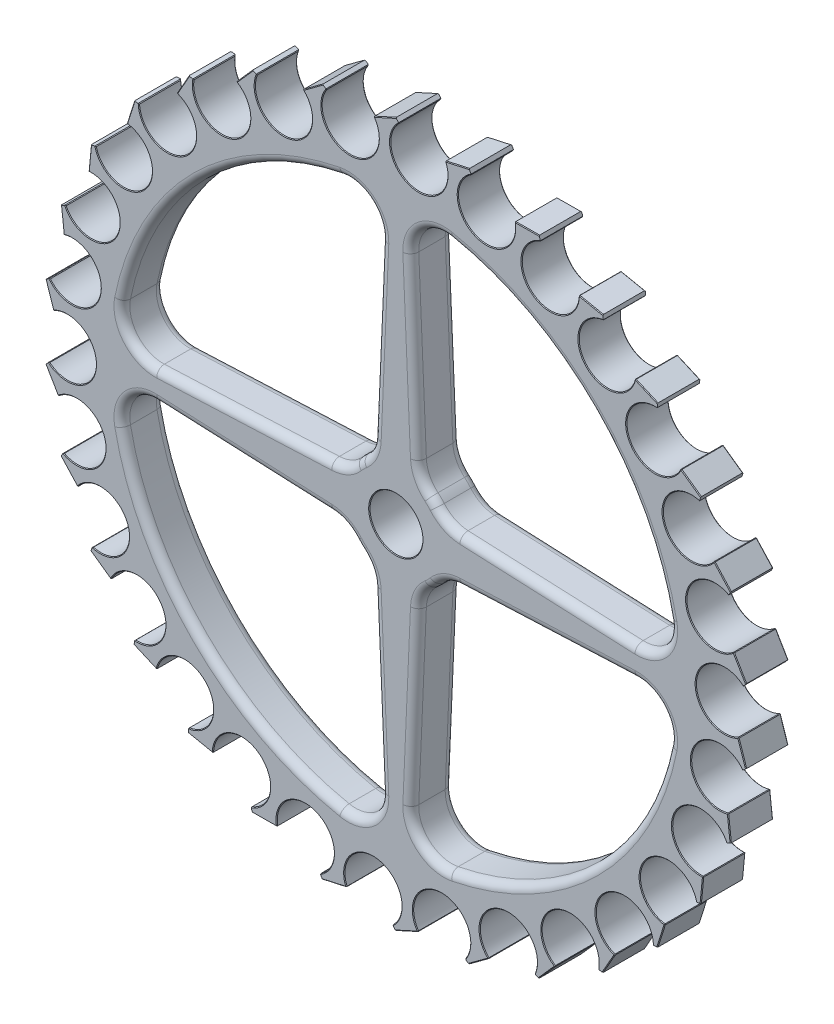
SolidWorks part; units mm, degrees
ref_plane "Спереди" through (0, 0, 0) normal (0, 0, 1) x (1, 0, 0)
ref_plane "Сверху" through (0, 0, 0) normal (0, 1, 0) x (1, 0, 0)
ref_plane "Справа" through (0, 0, 0) normal (1, 0, 0) x (0, 0, -1)
sketch "Эскиз1" plane through (0, 0, 0) normal (0, 0, 1) x (1, 0, 0)
  line L0 (0, 133) -> (0, 0) construction
  line L1 (0, 0) -> (9.2776, 132.676) construction
  line L2 (0, 133) -> (-8.4358, 129.1584)
  line L3 (27.6523, 130.0936) -> (18.6021, 128.0898)
  line L4 (54.096, 121.5015) -> (44.827, 121.4232)
  line L5 (78.1754, 107.5993) -> (69.0927, 109.4497)
  line L6 (98.8383, 88.9944) -> (90.3387, 92.6928)
  line L7 (115.1814, 66.5) -> (107.6365, 71.8848)
  line L8 (126.4905, 41.0993) -> (120.2301, 47.935)
  line L9 (132.2714, 13.9023) -> (127.569, 21.8903)
  line L10 (132.2714, -13.9023) -> (129.3326, -5.1111)
  line L11 (126.4905, -41.0993) -> (125.4437, -31.8892)
  line L12 (115.1814, -66.5) -> (116.0723, -57.2736)
  line L13 (98.8383, -88.9944) -> (101.628, -80.1548)
  line L14 (78.1754, -107.5993) -> (82.7421, -99.5329)
  line L15 (54.096, -121.5015) -> (60.2399, -114.5609)
  line L16 (27.6523, -130.0936) -> (35.105, -124.582)
  line L17 (0, -133) -> (8.4358, -129.1584)
  line L18 (-27.6523, -130.0936) -> (-18.6021, -128.0898)
  line L19 (-54.096, -121.5015) -> (-44.827, -121.4232)
  line L20 (-78.1754, -107.5993) -> (-69.0927, -109.4497)
  line L21 (-98.8383, -88.9944) -> (-90.3387, -92.6928)
  line L22 (-115.1814, -66.5) -> (-107.6365, -71.8848)
  line L23 (-126.4905, -41.0993) -> (-120.2301, -47.935)
  line L24 (-132.2714, -13.9023) -> (-127.569, -21.8903)
  line L25 (-132.2714, 13.9023) -> (-129.3326, 5.1111)
  line L26 (-126.4905, 41.0993) -> (-125.4437, 31.8892)
  line L27 (-115.1814, 66.5) -> (-116.0723, 57.2736)
  line L28 (-98.8383, 88.9944) -> (-101.628, 80.1548)
  line L29 (-78.1754, 107.5993) -> (-82.7421, 99.5329)
  line L30 (-54.096, 121.5015) -> (-60.2399, 114.5609)
  line L31 (-27.6523, 130.0936) -> (-35.105, 124.582)
  line L32 (0, 133) -> (1.2296, 131.7036)
  line L33 (27.6523, 130.0936) -> (28.5854, 128.5699)
  line L34 (54.096, 121.5015) -> (54.6919, 119.8171)
  line L35 (78.1754, 107.5993) -> (78.4082, 105.8277)
  line L36 (98.8383, 88.9944) -> (98.6976, 87.2132)
  line L37 (115.1814, 66.5) -> (114.6734, 64.787)
  line L38 (126.4905, 41.0993) -> (125.6375, 39.5293)
  line L39 (132.2714, 13.9023) -> (131.1106, 12.5439)
  line L40 (132.2714, -13.9023) -> (130.8536, -14.9896)
  line L41 (126.4905, -41.0993) -> (124.8776, -41.868)
  line L42 (115.1814, -66.5) -> (113.4439, -66.9166)
  line L43 (98.8383, -88.9944) -> (97.0521, -89.0407)
  line L44 (78.1754, -107.5993) -> (76.4187, -107.2732)
  line L45 (54.096, -121.5015) -> (52.4454, -120.8173)
  line L46 (27.6523, -130.0936) -> (26.18, -129.0812)
  line L47 (0, -133) -> (-1.2296, -131.7036)
  line L48 (-27.6523, -130.0936) -> (-28.5854, -128.5699)
  line L49 (-54.096, -121.5015) -> (-54.6919, -119.8171)
  line L50 (-78.1754, -107.5993) -> (-78.4082, -105.8277)
  line L51 (-98.8383, -88.9944) -> (-98.6976, -87.2132)
  line L52 (-115.1814, -66.5) -> (-114.6734, -64.787)
  line L53 (-126.4905, -41.0993) -> (-125.6375, -39.5293)
  line L54 (-132.2714, -13.9023) -> (-131.1106, -12.5439)
  line L55 (-132.2714, 13.9023) -> (-130.8536, 14.9896)
  line L56 (-126.4905, 41.0993) -> (-124.8776, 41.868)
  line L57 (-115.1814, 66.5) -> (-113.4439, 66.9166)
  line L58 (-98.8383, 88.9944) -> (-97.0521, 89.0407)
  line L59 (-78.1754, 107.5993) -> (-76.4187, 107.2732)
  line L60 (-54.096, 121.5015) -> (-52.4454, 120.8173)
  line L61 (-27.6523, 130.0936) -> (-26.18, 129.0812)
  line L62 (0, 0) -> (-133, 0) construction
  line L63 (-5.657, 90.4125) -> (-8.5437, 24.2976)
  line L64 (-90.4125, 5.657) -> (-24.2976, 8.5437)
  line L65 (-5.0144, 105.1305) -> (-3.8, 132.9457) construction
  line L66 (-105.1305, 5.0144) -> (-132.9457, 3.8) construction
  line L67 (90.4125, 5.657) -> (24.2976, 8.5437)
  line L68 (5.657, 90.4125) -> (8.5437, 24.2976)
  line L69 (5.657, -90.4125) -> (8.5437, -24.2976)
  line L70 (90.4125, -5.657) -> (24.2976, -8.5437)
  line L71 (-90.4125, -5.657) -> (-24.2976, -8.5437)
  line L72 (-5.657, -90.4125) -> (-8.5437, -24.2976)
  circle A0 centre (0, 0) radius 10
  circle A1 centre (0, 0) radius 133 construction
  circle A2 centre (0, 0) radius 124.17 construction
  arc A3 (1.2296, 131.7036) -> (18.6021, 128.0898) centre (8.6617, 123.8675) ccw
  arc A4 (28.5854, 128.5699) -> (44.827, 121.4232) centre (34.2259, 119.3599) ccw
  arc A5 (54.6919, 119.8171) -> (69.0927, 109.4497) centre (58.2943, 109.6356) ccw
  arc A6 (78.4082, 105.8277) -> (90.3387, 92.6928) centre (79.8149, 95.1197) ccw
  arc A7 (98.6976, 87.2132) -> (107.6365, 71.8848) centre (97.8473, 76.4467) ccw
  arc A8 (114.6734, 64.787) -> (120.2301, 47.935) centre (111.6033, 54.4325) ccw
  arc A9 (125.6375, 39.5293) -> (127.569, 21.8903) centre (120.4816, 30.0394) ccw
  arc A10 (131.1106, 12.5439) -> (129.3326, -5.1111) centre (124.0944, 4.3335) ccw
  arc A11 (130.8536, -14.9896) -> (125.4437, -31.8892) centre (122.2836, -21.5619) ccw
  arc A12 (124.8776, -41.868) -> (116.0723, -57.2736) centre (115.1284, -46.5149) ccw
  arc A13 (113.4439, -66.9166) -> (101.628, -80.1548) centre (102.9416, -69.435) ccw
  arc A14 (97.0521, -89.0407) -> (82.7421, -99.5329) centre (86.2557, -89.3204) ccw
  arc A15 (76.4187, -107.2732) -> (60.2399, -114.5609) centre (65.8001, -105.3021) ccw
  arc A16 (52.4454, -120.8173) -> (35.105, -124.582) centre (42.4686, -116.6816) ccw
  arc A17 (26.18, -129.0812) -> (8.4358, -129.1584) centre (17.2811, -122.9616) ccw
  arc A18 (-1.2296, -131.7036) -> (-18.6021, -128.0898) centre (-8.6617, -123.8675) ccw
  arc A19 (-28.5854, -128.5699) -> (-44.827, -121.4232) centre (-34.2259, -119.3599) ccw
  arc A20 (-54.6919, -119.8171) -> (-69.0927, -109.4497) centre (-58.2943, -109.6356) ccw
  arc A21 (-78.4082, -105.8277) -> (-90.3387, -92.6928) centre (-79.8149, -95.1197) ccw
  arc A22 (-98.6976, -87.2132) -> (-107.6365, -71.8848) centre (-97.8473, -76.4467) ccw
  arc A23 (-114.6734, -64.787) -> (-120.2301, -47.935) centre (-111.6033, -54.4325) ccw
  arc A24 (-125.6375, -39.5293) -> (-127.569, -21.8903) centre (-120.4816, -30.0394) ccw
  arc A25 (-131.1106, -12.5439) -> (-129.3326, 5.1111) centre (-124.0944, -4.3335) ccw
  arc A26 (-130.8536, 14.9896) -> (-125.4437, 31.8892) centre (-122.2836, 21.5619) ccw
  arc A27 (-124.8776, 41.868) -> (-116.0723, 57.2736) centre (-115.1284, 46.5149) ccw
  arc A28 (-113.4439, 66.9166) -> (-101.628, 80.1548) centre (-102.9416, 69.435) ccw
  arc A29 (-97.0521, 89.0407) -> (-82.7421, 99.5329) centre (-86.2557, 89.3204) ccw
  arc A30 (-76.4187, 107.2732) -> (-60.2399, 114.5609) centre (-65.8001, 105.3021) ccw
  arc A31 (-52.4454, 120.8173) -> (-35.105, 124.582) centre (-42.4686, 116.6816) ccw
  arc A32 (-26.18, 129.0812) -> (-8.4358, 129.1584) centre (-17.2811, 122.9616) ccw
  arc A33 (-20.5906, 103.2162) -> (-103.2162, 20.5906) centre (0, 0) ccw
  arc A34 (-12.9551, 15.3026) -> (-15.3026, 12.9551) centre (0, 0) ccw
  arc A35 (-24.2976, 8.5437) -> (-15.3026, 12.9551) centre (-24.8428, 21.0318) ccw
  arc A36 (-8.5437, 24.2976) -> (-12.9551, 15.3026) centre (-21.0318, 24.8428) cw
  arc A37 (-5.657, 90.4125) -> (-20.5906, 103.2162) centre (-18.1451, 90.9578) ccw
  arc A38 (-90.4125, 5.657) -> (-103.2162, 20.5906) centre (-90.9578, 18.1451) cw
  arc A39 (103.2162, 20.5906) -> (20.5906, 103.2162) centre (0, 0) ccw
  arc A40 (90.4125, 5.657) -> (103.2162, 20.5906) centre (90.9578, 18.1451) ccw
  arc A41 (5.657, 90.4125) -> (20.5906, 103.2162) centre (18.1451, 90.9578) cw
  arc A42 (8.5437, 24.2976) -> (12.9551, 15.3026) centre (21.0318, 24.8428) ccw
  arc A43 (15.3026, 12.9551) -> (12.9551, 15.3026) centre (0, 0) ccw
  arc A44 (24.2976, 8.5437) -> (15.3026, 12.9551) centre (24.8428, 21.0318) cw
  arc A45 (20.5906, -103.2162) -> (103.2162, -20.5906) centre (0, 0) ccw
  arc A46 (5.657, -90.4125) -> (20.5906, -103.2162) centre (18.1451, -90.9578) ccw
  arc A47 (90.4125, -5.657) -> (103.2162, -20.5906) centre (90.9578, -18.1451) cw
  arc A48 (24.2976, -8.5437) -> (15.3026, -12.9551) centre (24.8428, -21.0318) ccw
  arc A49 (12.9551, -15.3026) -> (15.3026, -12.9551) centre (0, 0) ccw
  arc A50 (8.5437, -24.2976) -> (12.9551, -15.3026) centre (21.0318, -24.8428) cw
  arc A51 (-103.2162, -20.5906) -> (-20.5906, -103.2162) centre (0, 0) ccw
  arc A52 (-90.4125, -5.657) -> (-103.2162, -20.5906) centre (-90.9578, -18.1451) ccw
  arc A53 (-5.657, -90.4125) -> (-20.5906, -103.2162) centre (-18.1451, -90.9578) cw
  arc A54 (-8.5437, -24.2976) -> (-12.9551, -15.3026) centre (-21.0318, -24.8428) ccw
  arc A55 (-15.3026, -12.9551) -> (-12.9551, -15.3026) centre (0, 0) ccw
  arc A56 (-24.2976, -8.5437) -> (-15.3026, -12.9551) centre (-24.8428, -21.0318) cw
  dimension "D1" = 20
  dimension "D2" = 266
  dimension "D3" = 248.34
  dimension "D4" = 21.6
  dimension "D6" = 210.5
  dimension "D14" = 40.1
  dimension "D19" = 12.5
  dimension "D5" = 4
  dimension "D7" = 25.9586
  dimension "D9" = 109
  dimension "D11" = 12
  dimension "D12" = 12
  dimension "D13" = 109
  dimension "D15" = 2.5
  dimension "D16" = 2.5
  dimension "D17" = 3.8
  dimension "D18" = 3.8
  dimension "D8" = 30
  dimension "D10" = 30
  dimension "D20" = 4
extrude "Бобышка-Вытянуть1" add sketch "Эскиз1" along normal mid plane 16
fillet "Скругление1" radius 3 64 edges at (9.8088, -19.3388, 8) (14.1775, -14.1775, 8) (19.3388, -9.8088, 8) (57.3551, -7.1004, 8) (100.4474, -10.009, 8) (74.423, -74.423, 8) (10.009, -100.4474, 8) (9.8088, -19.3388, -8) (14.1775, -14.1775, -8) (19.3388, -9.8088, -8) (57.3551, -7.1004, -8) (100.4474, -10.009, -8) (74.423, -74.423, -8) (10.009, -100.4474, -8) (14.1775, 14.1775, 8) (9.8088, 19.3388, 8) (7.1004, 57.3551, 8) (10.009, 100.4474, 8) (74.423, 74.423, 8) (100.4474, 10.009, 8) (57.3551, 7.1004, 8) (14.1775, 14.1775, -8) (9.8088, 19.3388, -8) (7.1004, 57.3551, -8) (10.009, 100.4474, -8) (74.423, 74.423, -8) (100.4474, 10.009, -8) (57.3551, 7.1004, -8) (-100.4474, -10.009, 8) (-57.3551, -7.1004, 8) (-19.3388, -9.8088, 8) (-14.1775, -14.1775, 8) (-9.8088, -19.3388, 8) (-7.1004, -57.3551, 8) (-10.009, -100.4474, 8) (-100.4474, -10.009, -8) (-57.3551, -7.1004, -8) (-19.3388, -9.8088, -8) (-14.1775, -14.1775, -8) (-9.8088, -19.3388, -8) (-7.1004, -57.3551, -8) (-10.009, -100.4474, -8) (-100.4474, 10.009, 8) (-74.423, 74.423, 8) (-10.009, 100.4474, 8) (-7.1004, 57.3551, 8) (-9.8088, 19.3388, 8) (-14.1775, 14.1775, 8) (-19.3388, 9.8088, 8) (-100.4474, 10.009, -8) (-74.423, 74.423, -8) (-10.009, 100.4474, -8) (-7.1004, 57.3551, -8) (-9.8088, 19.3388, -8) (-14.1775, 14.1775, -8) (-19.3388, 9.8088, -8) (7.1004, -57.3551, 8) (7.1004, -57.3551, -8) (19.3388, 9.8088, 8) (19.3388, 9.8088, -8) (-74.423, -74.423, 8) (-74.423, -74.423, -8) (-57.3551, 7.1004, 8) (-57.3551, 7.1004, -8)
chamfer "Фаска1" distance 0.25 angle 45 122 edges at (-129.3326, 5.1111, 0) (-113.3487, -5.4157, 8) (-131.1106, -12.5439, 0) (-113.3487, -5.4157, -8) (-127.569, -21.8903, 0) (-109.7458, -28.8638, 8) (-125.6375, -39.5293, 0) (-109.7458, -28.8638, -8) (-120.2301, -47.935, 0) (-101.3465, -51.0505, 8) (-114.6734, -64.787, 0) (-101.3465, -51.0505, -8) (-107.6365, -71.8848, 0) (-88.5178, -71.0061, 8) (-98.6976, -87.2132, 0) (-88.5178, -71.0061, -8) (-90.3387, -92.6928, 0) (-71.8205, -87.8583, 8) (-78.4082, -105.8277, 0) (-71.8205, -87.8583, -8) (-69.0927, -109.4497, 0) (-51.9843, -100.8707, 8) (-54.6919, -119.8171, 0) (-51.9843, -100.8707, -8) (-44.827, -121.4232, 0) (-29.8761, -109.4746, 8) (-28.5854, -128.5699, 0) (-29.8761, -109.4746, -8) (-18.6021, -128.0898, 0) (-6.4622, -113.2939, 8) (-1.2296, -131.7036, 0) (-6.4622, -113.2939, -8) (8.4358, -129.1584, 0) (17.2342, -112.1617, 8) (26.18, -129.0812, 0) (17.2342, -112.1617, -8) (35.105, -124.582, 0) (40.1773, -106.1275, 8) (52.4454, -120.8173, 0) (40.1773, -106.1275, -8) (60.2399, -114.5609, 0) (61.3645, -95.455, 8) (76.4187, -107.2732, 0) (61.3645, -95.455, -8) (82.7421, -99.5329, 0) (79.8697, -80.6107, 8) (97.0521, -89.0407, 0) (79.8697, -80.6107, -8) (101.628, -80.1548, 0) (94.8843, -62.2433, 8) (113.4439, -66.9166, 0) (94.8843, -62.2433, -8) (116.0723, -57.2736, 0) (105.752, -41.1556, 8) (124.8776, -41.868, 0) (105.752, -41.1556, -8) (125.4437, -31.8892, 0) (111.9978, -18.2692, 8) (130.8536, -14.9896, 0) (111.9978, -18.2692, -8) (129.3326, -5.1111, 0) (113.3487, 5.4157, 8) (131.1106, 12.5439, 0) (113.3487, 5.4157, -8) (127.569, 21.8903, 0) (109.7458, 28.8638, 8) (125.6375, 39.5293, 0) (109.7458, 28.8638, -8) (120.2301, 47.935, 0) (101.3465, 51.0505, 8) (114.6734, 64.787, 0) (101.3465, 51.0505, -8) (107.6365, 71.8848, 0) (88.5178, 71.0061, 8) (98.6976, 87.2132, 0) (88.5178, 71.0061, -8) (90.3387, 92.6928, 0) (71.8205, 87.8583, 8) (78.4082, 105.8277, 0) (71.8205, 87.8583, -8) (69.0927, 109.4497, 0) (51.9843, 100.8707, 8) (54.6919, 119.8171, 0) (51.9843, 100.8707, -8) (44.827, 121.4232, 0) (29.8761, 109.4746, 8) (28.5854, 128.5699, 0) (29.8761, 109.4746, -8) (18.6021, 128.0898, 0) (6.4622, 113.2939, 8) (1.2296, 131.7036, 0) (6.4622, 113.2939, -8) (-8.4358, 129.1584, 0) (-17.2342, 112.1617, 8) (-26.18, 129.0812, 0) (-17.2342, 112.1617, -8) (-35.105, 124.582, 0) (-40.1773, 106.1275, 8) (-52.4454, 120.8173, 0) (-40.1773, 106.1275, -8) (-60.2399, 114.5609, 0) (-61.3645, 95.455, 8) (-76.4187, 107.2732, 0) (-61.3645, 95.455, -8) (-82.7421, 99.5329, 0) (-79.8697, 80.6107, 8) (-97.0521, 89.0407, 0) (-79.8697, 80.6107, -8) (-101.628, 80.1548, 0) (-94.8843, 62.2433, 8) (-113.4439, 66.9166, 0) (-94.8843, 62.2433, -8) (-116.0723, 57.2736, 0) (-105.752, 41.1556, 8) (-124.8776, 41.868, 0) (-105.752, 41.1556, -8) (-125.4437, 31.8892, 0) (-111.9978, 18.2692, 8) (-130.8536, 14.9896, 0) (-111.9978, 18.2692, -8) (10, 0, -8) (10, 0, 8)
chamfer "Фаска2" distance 0.25 angle 45 60 edges at (94.705, 90.7929, -8) (111.5124, 69.1186, -8) (123.4461, 44.4234, -8) (129.9847, 17.7868, -8) (130.8423, -9.6273, -8) (125.9815, -36.6205, -8) (115.6146, -62.0133, -8) (100.1949, -84.6958, -8) (80.3961, -103.6767, -8) (57.0837, -118.1264, -8) (31.2764, -127.4134, -8) (4.1022, -131.1319, -8) (-23.2513, -129.1192, -8) (-49.5886, -121.4634, -8) (-73.7586, -108.4991, -8) (-94.705, -90.7929, -8) (-111.5124, -69.1186, -8) (-123.4461, -44.4234, -8) (-129.9847, -17.7868, -8) (-130.8423, 9.6273, -8) (-125.9815, 36.6205, -8) (-115.6146, 62.0133, -8) (-100.1949, 84.6958, -8) (-80.3961, 103.6767, -8) (-57.0837, 118.1264, -8) (-31.2764, 127.4134, -8) (-4.1022, 131.1319, -8) (73.7586, 108.4991, -8) (49.5886, 121.4634, -8) (23.2513, 129.1192, -8) (73.7586, 108.4991, 8) (94.705, 90.7929, 8) (111.5124, 69.1186, 8) (123.4461, 44.4234, 8) (129.9847, 17.7868, 8) (130.8423, -9.6273, 8) (125.9815, -36.6205, 8) (115.6146, -62.0133, 8) (100.1949, -84.6958, 8) (80.3961, -103.6767, 8) (57.0837, -118.1264, 8) (31.2764, -127.4134, 8) (4.1022, -131.1319, 8) (-23.2513, -129.1192, 8) (-49.5886, -121.4634, 8) (-73.7586, -108.4991, 8) (-94.705, -90.7929, 8) (-111.5124, -69.1186, 8) (-123.4461, -44.4234, 8) (-129.9847, -17.7868, 8) (-130.8423, 9.6273, 8) (-125.9815, 36.6205, 8) (-115.6146, 62.0133, 8) (-100.1949, 84.6958, 8) (-80.3961, 103.6767, 8) (-57.0837, 118.1264, 8) (-31.2764, 127.4134, 8) (49.5886, 121.4634, 8) (23.2513, 129.1192, 8) (-4.1022, 131.1319, 8)
